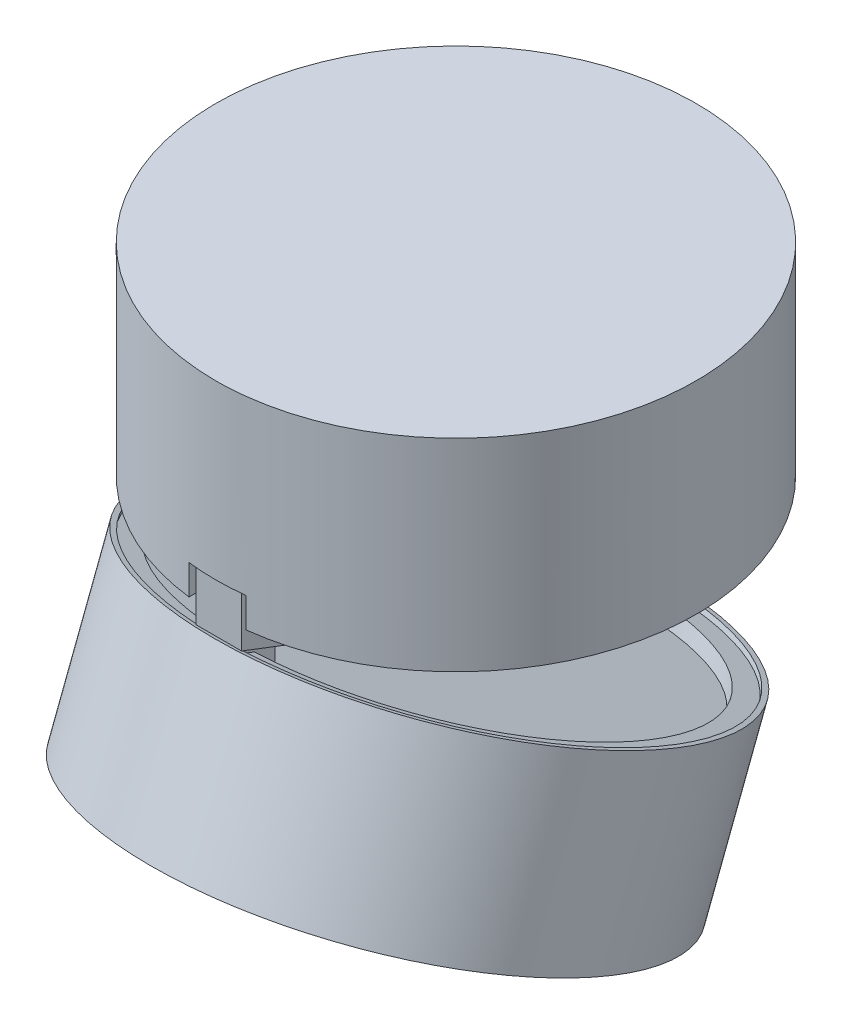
SolidWorks part; units mm, degrees
ref_plane "Alzado" through (0, 0, 0) normal (0, 0, 1) x (1, 0, 0)
ref_plane "Planta" through (0, 0, 0) normal (0, 1, 0) x (1, 0, 0)
ref_plane "Vista lateral" through (0, 0, 0) normal (1, 0, 0) x (0, 0, -1)
sketch "Croquis1" plane through (0, 0, 0) normal (0, 1, 0) x (1, 0, 0)
  circle A0 centre (0, 0) radius 47.5
extrude "Saliente-Extruir1" add sketch "Croquis1" along normal blind 40
sketch "Croquis2" plane through (0, 0, 0) normal (0, -1, 0) x (1, 0, 0)
  circle A0 centre (0, 0) radius 45
extrude "Cortar-Extruir1" cut sketch "Croquis2" against normal blind 1
ref_plane "Plano1" through (0, 0, 40) normal (0, 0, 1) x (1, 0, 0)
sketch "Croquis3" plane through (0, 0, 40) normal (0, 0, 1) x (1, 0, 0)
  line L1 (-5.6217, -5.9043) -> (5.6217, -5.9043)
  line L2 (-5.6217, -5.9043) -> (-5.6217, 5.9043)
  line L3 (-5.6217, 5.9043) -> (5.6217, 5.9043)
  line L4 (5.6217, -5.9043) -> (5.6217, 5.9043)
  line L5 (-5.6217, -5.9043) -> (5.6217, 5.9043) construction
  line L6 (-5.6217, 5.9043) -> (5.6217, -5.9043) construction
  point P0 (0, 0)
extrude "Cortar-Extruir2" cut sketch "Croquis3" along normal blind 28
sketch "Croquis4" plane through (0, 0, 40) normal (0, 0, 1) x (1, 0, 0)
  line L4 (-5.6217, -5.9043) -> (5.6217, -5.9043)
  line L5 (5.6217, -5.9043) -> (5.6217, 5.9043)
  line L6 (5.6217, 5.9043) -> (-5.6217, 5.9043)
  line L7 (-5.6217, 5.9043) -> (-5.6217, -5.9043)
  line L8 (-5.6217, -5.9043) -> (5.6217, -5.9043)
  line L9 (5.6217, -5.9043) -> (5.6217, 5.9043)
  line L10 (5.6217, 5.9043) -> (-5.6217, 5.9043)
  line L11 (-5.6217, 5.9043) -> (-5.6217, -5.9043)
  dimension "D1" = 0
extrude "Cortar-Extruir3" cut sketch "Croquis4" against normal blind 2
sketch "Croquis5" plane through (0, 5.9043, 0) normal (0, -1, 0) x (1, 0, 0)
  line L1 (-4.4933, 46.898) -> (4.4933, 46.898)
  line L2 (-4.4933, 46.898) -> (-4.4933, 38.2681)
  line L3 (-4.4933, 38.2681) -> (4.4933, 38.2681)
  line L4 (4.4933, 46.898) -> (4.4933, 38.2681)
  line L5 (-4.4933, 46.898) -> (4.4933, 38.2681) construction
  line L6 (-4.4933, 38.2681) -> (4.4933, 46.898) construction
  point P0 (0, 42.5831)
extrude "Saliente-Extruir2" add sketch "Croquis5" along normal blind 15
sketch "Croquis6" plane through (0, 0, 0) normal (1, 0, 0) x (0, 0, -1)
  line L0 (-47.7901, -3.9819) -> (-3.3096, -21.0564)
  line L1 (47.5, 0) -> (47.5, 40) construction
  line L2 (-60.333, -36.6573) -> (-15.8525, -53.7317)
  line L3 (-47.7901, -3.9819) -> (-60.333, -36.6573)
  line L5 (-3.3096, -21.0564) -> (-15.8525, -53.7317)
  dimension "D1" = 35
revolve "Revolución1" add sketch "Croquis6" angle 360 about L5
shell "Vaciado1" thickness 2
sketch "Croquis8" plane through (0, -21.3266, 8.1865) normal (0, -0.9336, 0.3584) x (1, 0, 0)
  circle A2 centre (0, -4.4561) radius 43.6451
  circle A3 centre (0, -4.4561) radius 43.6451
  dimension "D1" = 2
extrude "Saliente-Extruir3" add sketch "Croquis8" along normal blind 33
sketch "Croquis9" plane through (0, -52.1348, 20.0127) normal (0, -0.9336, 0.3584) x (1, 0, 0)
  circle A1 centre (0, -4.4561) radius 43.6451
  circle A2 centre (0, -4.4561) radius 43.6451
  dimension "D1" = 0
extrude "Cortar-Extruir4" cut sketch "Croquis9" against normal blind 7 draft 54
sketch "Croquis10" plane through (0, -45.5997, 17.5041) normal (0, -0.9336, 0.3584) x (1, 0, 0)
  circle A0 centre (0, -4.4561) radius 33.0104
  circle A1 centre (0, -4.4561) radius 34.0104
  circle A2 centre (0, -4.4561) radius 34.0104
  dimension "D1" = 0
  dimension "D2" = 1
extrude "Cortar-Extruir5" cut sketch "Croquis10" against normal blind 2
shell "Vaciado2" thickness 1
ref_plane "Plano2" through (0, -28.7953, 11.0535) normal (0, 0.9336, -0.3584) x (1, 0, 0)
sketch "Croquis11" plane through (0, -28.7953, 11.0535) normal (0, 0.9336, -0.3584) x (1, 0, 0)
  line L0 (-3.4933, -38.0456) -> (3.4933, -38.0456)
  arc A0 (3.4933, -38.0456) -> (-3.4933, -38.0456) centre (0, 4.4561) ccw construction
  arc A1 (3.4933, -38.0456) -> (-3.4933, -38.0456) centre (0, 4.4561) ccw
extrude "Saliente-Extruir4" add sketch "Croquis11" along normal blind 6
sketch "Croquis12" plane through (0, 40, 0) normal (0, 1, 0) x (1, 0, 0)
  circle A0 centre (0, 0) radius 45.0588
